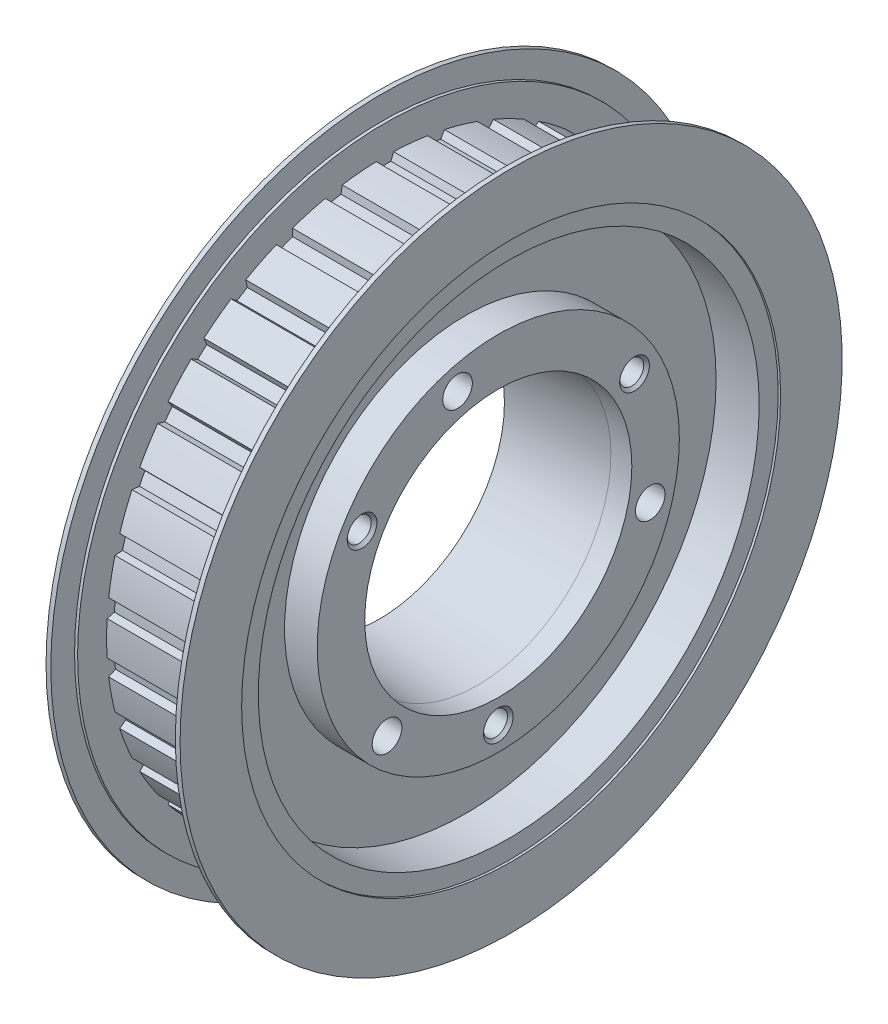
SolidWorks part; units mm, degrees
other "482213"
ref_plane "Front Plane" through (0, 0, 0) normal (0, 0, 1) x (1, 0, 0)
ref_plane "Top Plane" through (0, 0, 0) normal (0, 1, 0) x (1, 0, 0)
ref_plane "Right Plane" through (0, 0, 0) normal (1, 0, 0) x (0, 0, -1)
imported_body "482213.stp<1>"
scale "Scale1" scale about centroid uniform scaling yes scale factor 1
sketch "Sketch1" plane through (-17.272, 0, 0) normal (-1, 0, 0) x (0, 0, 1)
  circle A0 centre (0, 0) radius 72.0027
  circle A1 centre (0, 0) radius 66.9227 construction
  dimension "D1" = 5.08
extrude "Cut-Extrude1" cut sketch "Sketch1" against normal blind 0.635 contours A0 M3
ref_plane "Plane1" through (0, 0, 0) normal (-1, 0, 0) x (0, 0, 1)
mirror "Mirror1" about plane through (0, 0, 0) normal (-1, 0, 0) of "Cut-Extrude1"
sketch "Sketch2" plane through (-16.637, 0, 0) normal (-1, 0, 0) x (0, 0, 1)
  circle A1 centre (0, 0) radius 82.1055 construction
  circle A3 centre (0, 0) radius 88.4555
  point P0 (0, 0)
  point P2 (0, 0)
  dimension "D1" = 6.35
extrude "Boss-Extrude1" add sketch "Sketch2" along normal blind 1.27 separate body contours M3 M2 | A3 M3
mirror "Mirror3" about plane through (0, 0, 0) normal (-1, 0, 0)
